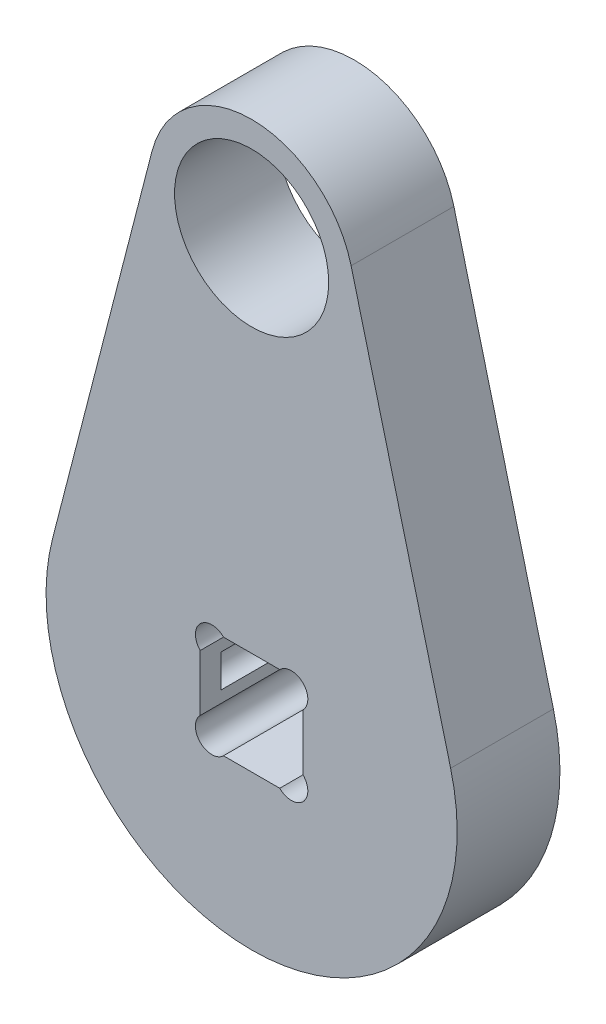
SolidWorks part; units mm, degrees
ref_plane "Plan de face" through (0, 0, 0) normal (0, 0, 1) x (1, 0, 0)
ref_plane "Plan de dessus" through (0, 0, 0) normal (0, 1, 0) x (1, 0, 0)
ref_plane "Plan de droite" through (0, 0, 0) normal (1, 0, 0) x (0, 0, -1)
sketch "Esquisse1" plane through (0, 0, 0) normal (0, 0, 1) x (1, 0, 0)
  line L0 (9.6825, 42.5) -> (19.3649, 5)
  line L1 (-9.6825, 42.5) -> (-19.3649, 5)
  arc A0 (-19.3649, 5) -> (19.3649, 5) centre (0, 0) ccw
  arc A1 (9.6825, 42.5) -> (-9.6825, 42.5) centre (0, 40) ccw
  circle A2 centre (0, 40) radius 7.5
  dimension "D1" = 40
extrude "Boss.-Extru.1" add sketch "Esquisse1" along normal blind 10
sketch "Esquisse2" plane through (0, 0, 0) normal (0, 0, -1) x (-1, 0, 0)
  line L0 (0, -5) -> (0, 6.3055) construction
  line L1 (-2.7373, 5) -> (2.7373, 5)
  line L2 (-5, 2.7373) -> (-5, -2.7373)
  line L3 (-2.7373, -5) -> (2.7373, -5)
  line L4 (5, 2.7373) -> (5, -2.7373)
  line L5 (-5, 5) -> (5, -5) construction
  line L6 (-5, -5) -> (5, 5) construction
  line L7 (5, 0) -> (-6.0269, 0) construction
  arc A0 (-2.7373, 5) -> (-5, 2.7373) centre (-3.8686, 3.8686) ccw
  arc A1 (-2.7373, -5) -> (-5, -2.7373) centre (-3.8686, -3.8686) cw
  arc A2 (2.7373, -5) -> (5, -2.7373) centre (3.8686, -3.8686) ccw
  arc A3 (2.7373, 5) -> (5, 2.7373) centre (3.8686, 3.8686) cw
  point P0 (0, 0)
  point P5 (-3.8686, 3.8686)
  dimension "D1" = 10
  dimension "D2" = 10
  dimension "D3" = 1.6
extrude "Enlèv. mat.-Extru.1" cut sketch "Esquisse2" against normal through all
sketch "Esquisse3" plane through (0, 0, 0) normal (0, 0, -1) x (-1, 0, 0)
  line L0 (-5, 0) -> (16.1031, 0) construction
  line L1 (-5, 2.7373) -> (-5, -2.7373) construction
  line L2 (0, 5) -> (0, -9.1073) construction
  line L3 (2.7373, 5) -> (-2.7373, 5) construction
  circle A0 centre (-5, 0) radius 1.6
  circle A1 centre (5, 0) radius 1.6
  dimension "D1" = 5
extrude "Enlèv. mat.-Extru.2" cut sketch "Esquisse3" against normal blind 8
